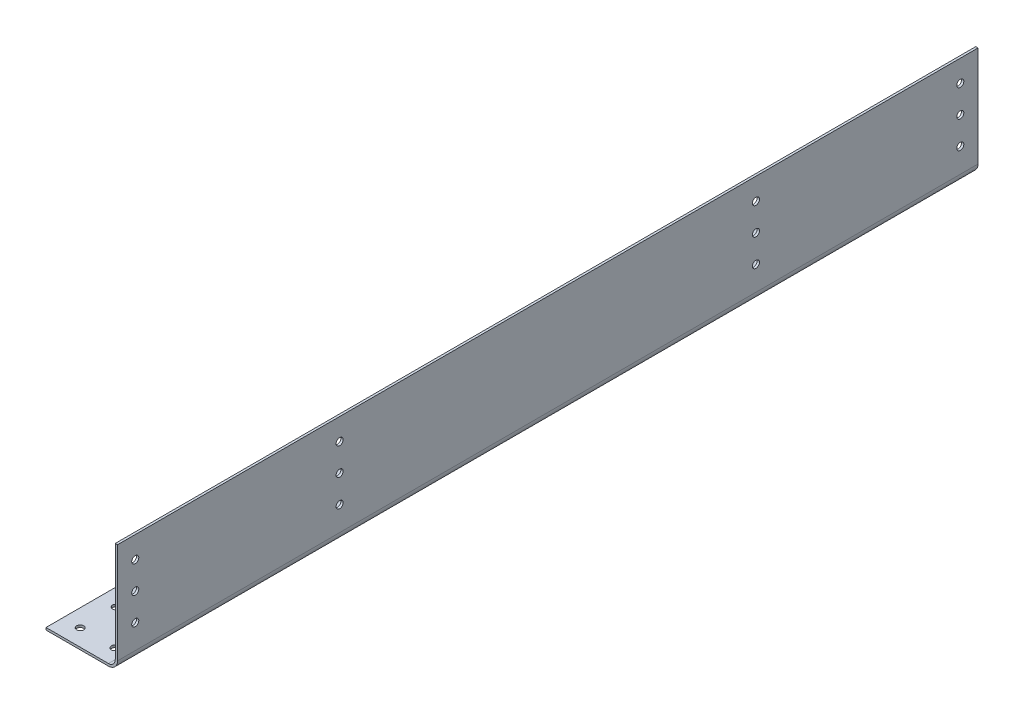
SolidWorks part; units mm, degrees
ref_plane "Front Plane" through (0, 0, 0) normal (0, 0, 1) x (1, 0, 0)
ref_plane "Top Plane" through (0, 0, 0) normal (0, 1, 0) x (1, 0, 0)
ref_plane "Right Plane" through (0, 0, 0) normal (1, 0, 0) x (0, 0, -1)
sketch "Mating panels" plane through (0, 0, 0) normal (0, 1, 0) x (1, 0, 0)
  line L0 (0, 598.4875) -> (0, -598.4875)
  line L5 (-152.4, 598.4875) -> (152.4, 598.4875)
  line L6 (-152.4, 598.4875) -> (-152.4, -598.4875)
  line L7 (-152.4, -598.4875) -> (152.4, -598.4875)
  line L8 (152.4, 598.4875) -> (152.4, -598.4875)
  line L9 (-152.4, 598.4875) -> (152.4, -598.4875) construction
  line L10 (-152.4, -598.4875) -> (152.4, 598.4875) construction
  circle A0 centre (24.13, -574.3575) radius 4.9022
  circle A1 centre (-24.13, -574.3575) radius 4.9022
  point P0 (0, 0)
  point P5 (0, 598.4875)
  point P6 (343.0043, -52.9848)
  point P14 (0, -598.4875)
  dimension "D4" = 9.8044
  dimension "D5" = 9.8044
  dimension "D1" = 1196.975
  dimension "D2" = 304.8
  dimension "D3" = 24.13
  dimension "D6" = 24.13
  dimension "D7" = 24.13
sketch "Panel base" plane through (0, 0, 0) normal (0, 1, 0) x (1, 0, 0)
  line L1 (-48.26, 597.6937) -> (38.4302, 597.6937)
  line L2 (-48.26, 597.6937) -> (-48.26, -597.6938)
  line L3 (-48.26, -597.6938) -> (38.4302, -597.6938)
  line L4 (38.4302, 597.6937) -> (38.4302, -597.6938)
  line L6 (-152.4, 598.4875) -> (152.4, 598.4875) construction
  line L7 (-152.4, -598.4875) -> (152.4, -598.4875) construction
  point P6 (0, 0)
  dimension "D1" = 0.7938
  dimension "D2" = 24.13
  dimension "D3" = 0.7937
  dimension "D4" = 14.3002
sketch "Sketch3" plane through (0, 0, 0) normal (0, 0, 1) x (1, 0, 0)
  line L0 (-48.26, 3.175) -> (38.4302, 3.175)
  line L1 (47.9552, 12.7) -> (47.9552, 152.4)
  line L3 (-48.26, 0) -> (-48.26, 3.175)
  line L4 (-48.26, 0) -> (38.4302, 0)
  line L5 (51.1302, 12.7) -> (51.1302, 152.4)
  line L6 (47.9552, 152.4) -> (51.1302, 152.4)
  arc A0 (38.4302, 3.175) -> (47.9552, 12.7) centre (38.4302, 12.7) ccw
  arc A1 (38.4302, 0) -> (51.1302, 12.7) centre (38.4302, 12.7) ccw
  dimension "D1" = 9.525
  dimension "D2" = 12.7
  dimension "D3" = 3.175
  dimension "D4" = 3.175
  dimension "D5" = 152.4
extrude "Boss-Extrude1" add sketch "Sketch3" along normal mid plane 1195.3875
sketch "Sketch4" plane through (0, 0, 0) normal (0, 1, 0) x (1, 0, 0)
  line L1 (-152.4, -598.4875) -> (152.4, -598.4875) construction
  line L2 (0, 598.4875) -> (0, -598.4875) construction
  circle A0 centre (-24.13, -574.3575) radius 4.9022
  circle A1 centre (24.13, -574.3575) radius 4.9022
  circle A50 centre (-24.13, -524.4134) radius 4.9022
  circle A51 centre (24.13, -524.4134) radius 4.9022
  circle A52 centre (-24.13, -474.4692) radius 4.9022
  circle A53 centre (24.13, -474.4692) radius 4.9022
  circle A54 centre (-24.13, -424.5251) radius 4.9022
  circle A55 centre (24.13, -424.5251) radius 4.9022
  circle A56 centre (-24.13, -374.581) radius 4.9022
  circle A57 centre (24.13, -374.581) radius 4.9022
  circle A58 centre (-24.13, -324.6368) radius 4.9022
  circle A59 centre (24.13, -324.6368) radius 4.9022
  circle A60 centre (-24.13, -274.6927) radius 4.9022
  circle A61 centre (24.13, -274.6927) radius 4.9022
  circle A62 centre (-24.13, -224.7486) radius 4.9022
  circle A63 centre (24.13, -224.7486) radius 4.9022
  circle A64 centre (-24.13, -174.8045) radius 4.9022
  circle A65 centre (24.13, -174.8045) radius 4.9022
  circle A66 centre (-24.13, -124.8603) radius 4.9022
  circle A67 centre (24.13, -124.8603) radius 4.9022
  circle A68 centre (-24.13, -74.9162) radius 4.9022
  circle A69 centre (24.13, -74.9162) radius 4.9022
  circle A70 centre (-24.13, -24.9721) radius 4.9022
  circle A71 centre (24.13, -24.9721) radius 4.9022
  circle A72 centre (-24.13, 24.9721) radius 4.9022
  circle A73 centre (24.13, 24.9721) radius 4.9022
  circle A74 centre (-24.13, 74.9162) radius 4.9022
  circle A75 centre (24.13, 74.9162) radius 4.9022
  circle A76 centre (-24.13, 124.8603) radius 4.9022
  circle A77 centre (24.13, 124.8603) radius 4.9022
  circle A78 centre (-24.13, 174.8045) radius 4.9022
  circle A79 centre (24.13, 174.8045) radius 4.9022
  circle A80 centre (-24.13, 224.7486) radius 4.9022
  circle A81 centre (24.13, 224.7486) radius 4.9022
  circle A82 centre (-24.13, 274.6927) radius 4.9022
  circle A83 centre (24.13, 274.6927) radius 4.9022
  circle A84 centre (-24.13, 324.6368) radius 4.9022
  circle A85 centre (24.13, 324.6368) radius 4.9022
  circle A86 centre (-24.13, 374.581) radius 4.9022
  circle A87 centre (24.13, 374.581) radius 4.9022
  circle A88 centre (-24.13, 424.5251) radius 4.9022
  circle A89 centre (24.13, 424.5251) radius 4.9022
  circle A90 centre (-24.13, 474.4692) radius 4.9022
  circle A91 centre (24.13, 474.4692) radius 4.9022
  circle A92 centre (-24.13, 524.4134) radius 4.9022
  circle A93 centre (24.13, 524.4134) radius 4.9022
  circle A94 centre (-24.13, 574.3575) radius 4.9022
  circle A95 centre (24.13, 574.3575) radius 4.9022
  dimension "D5" = 9.8044
  dimension "D6" = 9.8044
  dimension "D1" = 24.13
  dimension "D2" = 24.13
  dimension "D3" = 24.13
  dimension "D4" = 24
extrude "47in pnl holes" cut sketch "Sketch4" along normal blind 25.4
sketch "Sketch5" plane through (0, 0, 0) normal (1, 0, 0) x (0, 0, -1)
  line L0 (-670.394, 12.7) -> (-503.8762, 12.7) construction
  line L2 (-597.6938, 0) -> (597.6938, 0) construction
  line L3 (-597.6938, 12.7) -> (-597.6938, 152.4) construction
  line L4 (597.6938, 12.7) -> (597.6938, 152.4) construction
  circle A0 centre (-573.0875, 46.355) radius 4.9022
  circle A1 centre (573.0875, 46.355) radius 4.9022
  circle A48 centre (-573.0875, 84.2545) radius 4.9022
  circle A49 centre (573.0875, 84.2545) radius 4.9022
  circle A50 centre (-573.0875, 122.1539) radius 4.9022
  circle A51 centre (573.0875, 122.1539) radius 4.9022
  dimension "D2" = 9.8044
  dimension "D4" = 9.8044
  dimension "D1" = 46.355
  dimension "D3" = 24.6062
  dimension "D5" = 24.6063
  dimension "D6" = 3
extrude "Outerside holes" cut sketch "Sketch5" along normal blind 76.2
sketch "coil beam holes" [suppressed] plane through (0, 0, 0) normal (1, 0, 0) x (0, 0, -1)
  line L1 (-597.6938, 0) -> (597.6938, 0) construction
  circle A0 centre (-458.7875, 46.355) radius 4.9022
  circle A1 centre (458.7875, 46.355) radius 4.9022
  circle A26 centre (-573.0875, 46.355) radius 4.9022 construction
  circle A27 centre (573.0875, 46.355) radius 4.9022 construction
  circle A28 centre (-458.7875, 113.03) radius 4.9022
  circle A29 centre (458.7875, 113.03) radius 4.9022
  dimension "D1" = 9.8044
  dimension "D2" = 9.8044
  dimension "D3" = 114.3
  dimension "D4" = 46.355
  dimension "D5" = 114.3
  dimension "D6" = 2
sketch "L2 L6 brace" plane through (0, 0, 0) normal (1, 0, 0) x (0, 0, -1)
  circle A2 centre (-573.0875, 46.355) radius 4.9022 construction
  circle A3 centre (573.0875, 46.355) radius 4.9022 construction
  point P0 (0, 0)
  line B0 (-597.6938, 152.4) -> (597.6937, 152.4)
  line B1 (-597.6938, 152.4) -> (-597.6938, 12.7)
  line B2 (-597.6938, 4.2997) -> (-597.6938, 12.7)
  line B3 (597.6937, 152.4) -> (597.6937, 12.7)
  line B4 (597.6937, 4.2997) -> (597.6937, 12.7)
  circle B5 centre (289.1991, 122.1539) radius 4.9022
  circle B6 centre (289.1991, 84.2545) radius 4.9022
  circle B7 centre (289.1991, 46.355) radius 4.9022
  circle B8 centre (-289.1991, 122.1539) radius 4.9022
  circle B9 centre (-289.1991, 84.2545) radius 4.9022
  circle B10 centre (-289.1991, 46.355) radius 4.9022
  circle B11 centre (-573.0875, 122.1539) radius 4.9022
  circle B12 centre (-573.0875, 84.2545) radius 4.9022
  circle B13 centre (-573.0875, 46.355) radius 4.9022
  circle B14 centre (573.0875, 122.1539) radius 4.9022
  circle B15 centre (573.0875, 84.2545) radius 4.9022
  circle B16 centre (573.0875, 46.355) radius 4.9022
sketch_block_instance "L brace hol-1"
sketch_block "L brace hol"
sketch "Sketch8" plane through (0, 0, 0) normal (1, 0, 0) x (0, 0, -1)
  circle A0 centre (-289.1991, 46.355) radius 4.9022
  circle A1 centre (-289.1991, 84.2545) radius 4.9022
  circle A2 centre (-289.1991, 122.1539) radius 4.9022
  circle A3 centre (289.1991, 46.355) radius 4.9022
  circle A4 centre (289.1991, 84.2545) radius 4.9022
  circle A5 centre (289.1991, 122.1539) radius 4.9022
  circle A6 centre (-289.1991, 46.355) radius 4.9022 construction
  circle A7 centre (-289.1991, 84.2545) radius 4.9022 construction
  circle A8 centre (-289.1991, 122.1539) radius 4.9022 construction
  circle A9 centre (289.1991, 46.355) radius 4.9022 construction
  circle A10 centre (289.1991, 84.2545) radius 4.9022 construction
  circle A11 centre (289.1991, 122.1539) radius 4.9022 construction
  dimension "D1" = 9.8044
  dimension "D2" = 9.8044
  dimension "D3" = 9.8044
  dimension "D4" = 9.8044
  dimension "D5" = 9.8044
  dimension "D6" = 9.8044
extrude "Cut-Extrude4" cut sketch "Sketch8" along normal blind 76.2
